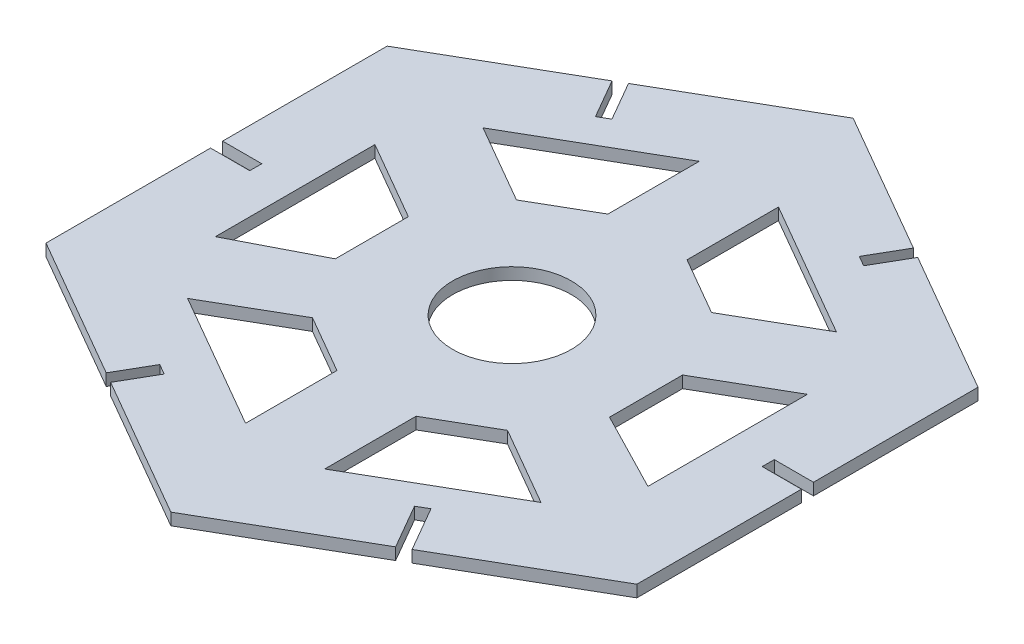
SolidWorks part; units mm, degrees
ref_plane "Front Plane" through (0, 0, 0) normal (0, 0, 1) x (1, 0, 0)
ref_plane "Top Plane" through (0, 0, 0) normal (0, 1, 0) x (1, 0, 0)
ref_plane "Right Plane" through (0, 0, 0) normal (1, 0, 0) x (0, 0, -1)
sketch "Sketch1" plane through (0, 0, 0) normal (0, 1, 0) x (1, 0, 0)
  line L0 (0, 1.1072) -> (0, 3.1748) construction
  line L1 (0, 65.235) -> (-54.641, 33.688)
  line L2 (34.641, -17.859) -> (34.641, 22.141)
  line L3 (34.641, 22.141) -> (0, 42.141)
  line L4 (0, 42.141) -> (-34.641, 22.141)
  line L5 (-34.641, 22.141) -> (-34.641, -17.859)
  line L6 (-34.641, -17.859) -> (0, -37.859)
  line L7 (0, -37.859) -> (34.641, -17.859)
  line L8 (-54.641, 33.688) -> (-54.641, -29.406)
  line L9 (-54.641, -29.406) -> (0, -60.953)
  line L10 (0, -60.953) -> (54.641, -29.406)
  line L11 (54.641, -29.406) -> (54.641, 33.688)
  line L12 (54.641, 33.688) -> (0, 65.235)
  line L13 (0, 65.235) -> (0, -63.0204) construction
  line L14 (54.641, 33.688) -> (-54.641, -29.406) construction
  line L15 (-54.641, 33.688) -> (54.641, -29.406) construction
  line L22 (-10, 59.4615) -> (-10, 36.3675)
  line L23 (10, 59.4615) -> (10, 36.3675)
  line L24 (-10, 59.4615) -> (0, 65.235)
  line L25 (-10, 36.3675) -> (0, 42.141)
  line L26 (0, 42.141) -> (10, 36.3675)
  line L27 (-44.641, 39.4615) -> (-24.641, 27.9145)
  line L28 (-24.641, 27.9145) -> (-34.641, 22.141)
  line L29 (-34.641, 10.594) -> (-54.641, 22.141)
  line L30 (-54.641, 22.141) -> (-54.641, 33.688)
  line L31 (34.641, 22.141) -> (34.641, -17.859)
  line L32 (54.641, 22.141) -> (54.641, 33.688)
  line L33 (34.641, 10.594) -> (54.641, 22.141)
  line L34 (24.641, 27.9145) -> (34.641, 22.141)
  line L35 (44.641, 39.4615) -> (24.641, 27.9145)
  line L36 (10, -32.0855) -> (10, -55.1795)
  line L37 (10, -55.1795) -> (0, -60.953)
  line L38 (-10, -55.1795) -> (-10, -32.0855)
  line L39 (-10, -32.0855) -> (0, -37.859)
  line L40 (-54.641, -18.158) -> (-34.641, -7.859)
  line L41 (-44.641, -35.1795) -> (-24.641, -23.6325)
  line L42 (44.641, -35.1795) -> (24.641, -23.6325)
  line L43 (54.641, -18.158) -> (34.641, -7.859)
  line L44 (0, 65.235) -> (0, -84.047) construction
  line L50 (53.5911, 2.141) -> (54.641, 2.141) construction
  arc A0 (0.1774, 36.7816) -> (0, 36.782) centre (0, 2.141) ccw construction
  dimension "D1" = 40
  dimension "D2" = 20
extrude "Boss-Extrude2" add sketch "Sketch1" along normal blind 3 contours L6 L7 L2 L31 L3 L4 L5 | L29 L5 L4 L27 L1 L8 | L38 L9 L10 L36 L7 L6 | L9 L41 L6 L5 L40 L8 | L11 L43 L2 L7 L42 L10 | L12 L35 L3 L31 L33 L11 | L23 L12 L1 L22 L4 L3
sketch "Sketch2" plane through (0, 3, 0) normal (0, 1, 0) x (1, 0, 0)
  line L0 (0, 65.235) -> (0, -60.953) construction
  line L1 (-10, -55.1795) -> (0, -60.953) construction
  line L2 (0, -84.047) -> (74.641, -40.953)
  line L3 (0, -60.953) -> (54.641, -29.406)
  line L4 (54.641, -29.406) -> (54.641, 33.688)
  line L5 (54.641, 33.688) -> (0, 65.235)
  line L6 (0, 65.235) -> (-54.641, 33.688)
  line L7 (-54.641, 33.688) -> (-54.641, -29.406)
  line L8 (-54.641, -29.406) -> (0, -60.953)
  line L9 (74.641, -40.953) -> (74.641, 45.235)
  line L10 (74.641, 45.235) -> (0, 88.329)
  line L11 (0, 88.329) -> (-74.641, 45.235)
  line L12 (-74.641, 45.235) -> (-74.641, -40.953)
  line L13 (-74.641, -40.953) -> (0, -84.047)
  line L14 (0, 88.329) -> (0, -84.047) construction
  line L16 (-74.641, 45.235) -> (74.641, -40.953) construction
  line L17 (74.641, 45.235) -> (-74.641, -40.953) construction
  line L18 (-37.3205, 66.782) -> (-27.3205, 49.4615) construction
  line L19 (-74.641, 0.617) -> (-74.641, 3.665)
  line L20 (-74.641, 3.665) -> (-74.641, 0.617)
  line L21 (-74.641, 0.617) -> (-64.735, 0.617)
  line L22 (-74.641, 3.665) -> (-64.735, 3.665)
  line L23 (37.3205, 66.782) -> (27.3205, 49.4615) construction
  line L24 (-27.3205, -45.1795) -> (-37.3205, -62.5) construction
  line L25 (37.3205, -62.5) -> (27.2419, -45.0434) construction
  line L26 (-38.6195, 66.032) -> (-35.9799, 67.556)
  line L27 (-38.6195, 66.032) -> (-32.9003, 56.126)
  line L28 (-35.9799, 67.556) -> (-30.2607, 57.65)
  line L29 (-32.9003, 56.126) -> (-30.2607, 57.65)
  line L30 (36.0215, 67.532) -> (38.6195, 66.032)
  line L31 (36.0215, 67.532) -> (31.0215, 58.8718)
  line L32 (38.6195, 66.032) -> (33.6195, 57.3718)
  line L33 (31.0215, 58.8718) -> (33.6195, 57.3718)
  line L34 (38.6403, -61.738) -> (36.0007, -63.262)
  line L35 (38.6403, -61.738) -> (32.1243, -50.4519)
  line L36 (36.0007, -63.262) -> (29.4846, -51.9759)
  line L37 (32.1243, -50.4519) -> (29.4846, -51.9759)
  line L38 (-38.6403, -61.738) -> (-36.0007, -63.262)
  line L39 (-38.6403, -61.738) -> (-33.6873, -53.1592)
  line L40 (-36.0007, -63.262) -> (-31.0477, -54.6832)
  line L41 (-33.6873, -53.1592) -> (-31.0477, -54.6832)
  line L42 (74.641, 0.617) -> (74.641, 3.665)
  line L43 (74.641, 0.617) -> (64.735, 0.617)
  line L44 (74.641, 3.665) -> (64.735, 3.665)
  line L45 (64.735, 0.617) -> (64.735, 3.665)
  line L46 (-64.735, 0.617) -> (-64.735, 3.665)
  line L47 (-54.641, 2.141) -> (54.641, 2.141) construction
  arc A0 (47.3205, 29.4615) -> (54.641, 2.141) centre (0, 2.141) ccw construction
  point P12 (-74.641, 2.141)
  point P18 (74.641, 2.141)
  dimension "D1" = 20
  dimension "D2" = 3.048
  dimension "D3" = 1.524
  dimension "D4" = 3.048
  dimension "D5" = 1.524
  dimension "D6" = 3.048
  dimension "D7" = 3.048
  dimension "D8" = 1.524
  dimension "D9" = 9.906
  dimension "D10" = 9.906
  dimension "D11" = 9.906
  dimension "D12" = 3.048
  dimension "D13" = 1.524
  dimension "D14" = 9.906
extrude "Boss-Extrude3" add sketch "Sketch2" against normal blind 3 contours L46 L21 L12 L13 L39 L41 L40 L2 L36 L37 L35 L9 L43 L45 L44 L10 L32 L33 L31 L11 L28 L29 L27 L22 L8 L7 L6 L5 L4 L3 M49 M48 M44 M43 M39 M38 M34 M33 M29 M28 M24 M23
sketch "Sketch3" plane through (0, 3, 0) normal (0, 1, 0) x (1, 0, 0)
  line L0 (0, 88.329) -> (0, -84.047) construction
  circle A0 centre (0, 2.141) radius 15
  dimension "D1" = 30
extrude "Cut-Extrude1" cut sketch "Sketch3" against normal blind 3
